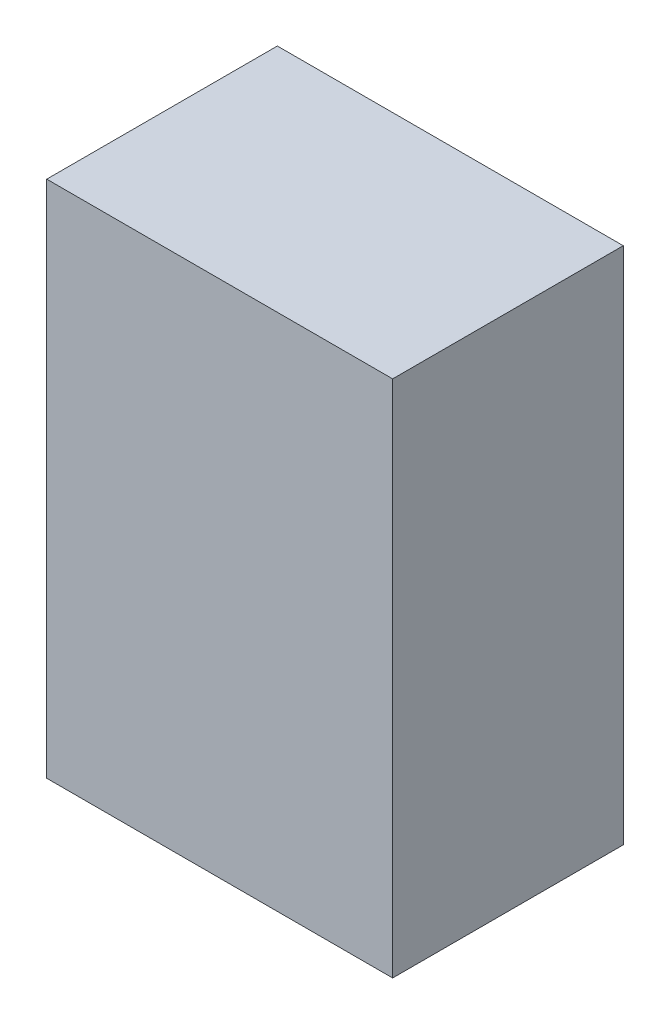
SolidWorks part; units mm, degrees
ref_plane "Front Plane" through (0, 0, 0) normal (0, 0, 1) x (1, 0, 0)
ref_plane "Top Plane" through (0, 0, 0) normal (0, 1, 0) x (1, 0, 0)
ref_plane "Right Plane" through (0, 0, 0) normal (1, 0, 0) x (0, 0, -1)
sketch "Sketch1" plane through (0, 0, 0) normal (0, 0, 1) x (1, 0, 0)
  line L1 (-38.1, -57.15) -> (38.1, -57.15)
  line L2 (-38.1, -57.15) -> (-38.1, 57.15)
  line L3 (-38.1, 57.15) -> (38.1, 57.15)
  line L4 (38.1, -57.15) -> (38.1, 57.15)
  line L5 (-38.1, -57.15) -> (38.1, 57.15) construction
  line L6 (-38.1, 57.15) -> (38.1, -57.15) construction
  point P0 (0, 0)
  dimension "D1" = 76.2
  dimension "D2" = 114.3
extrude "Boss-Extrude1" add sketch "Sketch1" along normal blind 50.8
